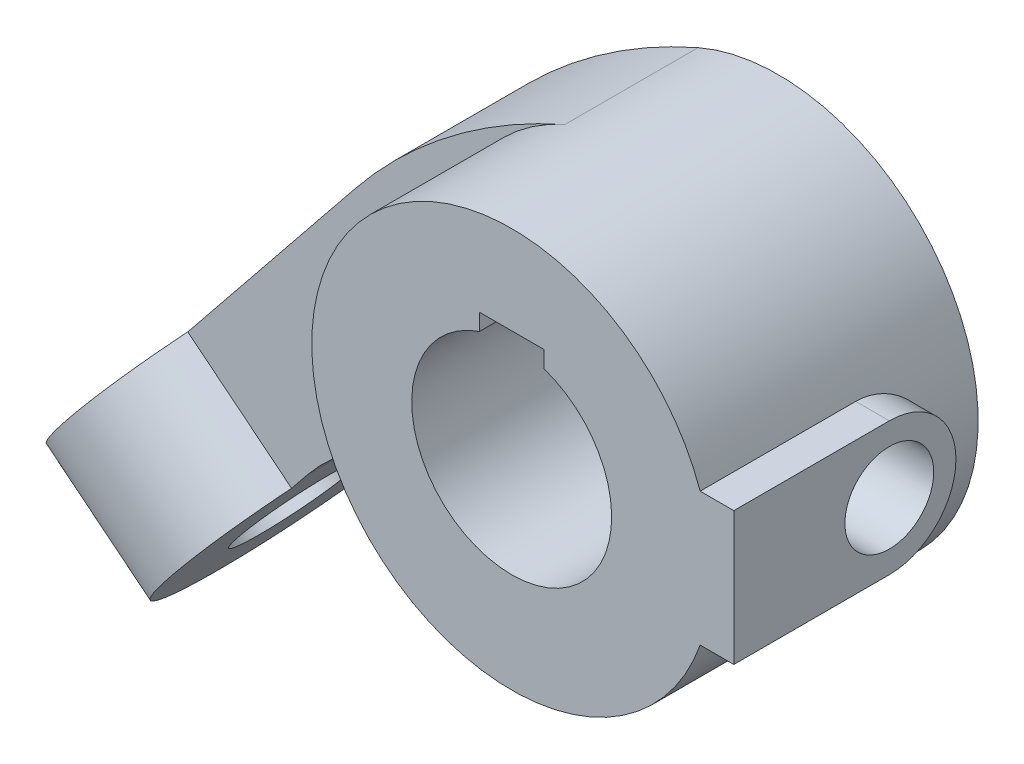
SolidWorks part; units mm, degrees
ref_plane "前视基准面" through (0, 0, 0) normal (0, 0, 1) x (1, 0, 0)
ref_plane "上视基准面" through (0, 0, 0) normal (0, 1, 0) x (1, 0, 0)
ref_plane "右视基准面" through (0, 0, 0) normal (1, 0, 0) x (0, 0, -1)
sketch "草图1" plane through (0, 0, 0) normal (0, 0, 1) x (1, 0, 0)
  line L0 (0, 0) -> (0, 15.4686) construction
  line L1 (-2.9007, 8.5197) -> (-2.9007, 10.0197)
  line L2 (-2.9007, 10.0197) -> (2.9007, 10.0197)
  line L3 (2.9007, 10.0197) -> (2.9007, 8.5197)
  circle A0 centre (0, 0) radius 18
  arc A1 (-2.9007, 8.5197) -> (2.9007, 8.5197) centre (0, 0) ccw
extrude "拉伸1" add sketch "草图1" along normal blind 24
sketch "草图2" plane through (0, 0, 0) normal (0, 0, -1) x (-1, 0, 0)
  line L0 (16.0387, 8.1708) -> (44.2651, -26.8759) construction
  line L1 (41.4315, -16.9807) -> (26.1041, 2.0502)
  line L2 (37.7431, -31.5321) -> (30.4178, -22.4368)
  line L3 (41.4315, -16.9807) -> (47.0889, -24.005)
  line L4 (47.0889, -24.005) -> (37.7431, -31.5321)
  circle A0 centre (0, 0) radius 18 construction
  arc A1 (26.1041, 2.0502) -> (7.2206, 16.4883) centre (-12.8366, -29.3125) ccw
  arc A2 (30.4178, -22.4368) -> (7.0302, -16.5703) centre (14.8415, -34.9818) ccw
  arc A3 (7.0302, -16.5703) -> (7.2206, 16.4883) centre (0, 0) ccw
  dimension "D2" = 4
  dimension "D1" = 8
extrude "拉伸2" add sketch "草图2" against normal blind 12
sketch "草图3" plane through (-7.4893, 6.0319, 0) normal (0.7788, -0.6273, 0) x (0, 0, -1)
  line L0 (-6, -48.2322) -> (-6, -31.9453) construction
  line L1 (-12, -48.2322) -> (0, -48.2322) construction
  circle A0 centre (-6, -48) radius 11
  dimension "D1" = 48
extrude "拉伸3" add sketch "草图3" against normal blind 12
sketch "草图4" plane through (-7.4893, 6.0319, 0) normal (0.7788, -0.6273, 0) x (0, 0, -1)
  circle A0 centre (-6, -48) radius 5
extrude "切除-拉伸1" cut sketch "草图4" against normal through all
ref_plane "基准面1" through (20, 0, 0) normal (1, 0, 0) x (0, 0, -1)
sketch "草图5" plane through (20, 0, 0) normal (1, 0, 0) x (0, 0, -1)
  line L0 (-10, 6) -> (-24, 6)
  line L1 (-24, 18) -> (-24, -18) construction
  line L2 (-24, 6) -> (-24, -6)
  line L3 (-24, -6) -> (-10, -6)
  arc A0 (-10, -6) -> (-10, 6) centre (-10, 0) ccw
  circle A1 centre (-10, 0) radius 4
extrude "拉伸4" add sketch "草图5" against normal up to next
sketch "草图6" plane through (20, 0, 0) normal (1, 0, 0) x (0, 0, -1)
  circle A0 centre (-10, 0) radius 4
extrude "切除-拉伸2" cut sketch "草图6" against normal up to surface (11 mm away)
